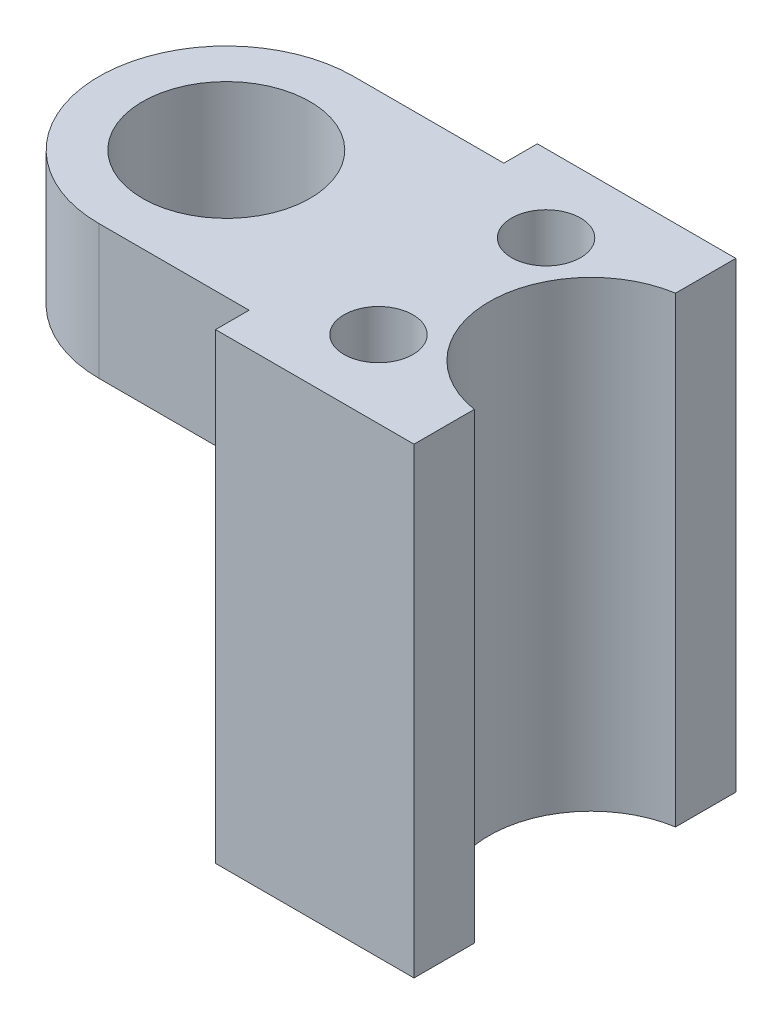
SolidWorks part; units mm, degrees
ref_plane "Front Plane" through (0, 0, 0) normal (0, 0, 1) x (1, 0, 0)
ref_plane "Top Plane" through (0, 0, 0) normal (0, 1, 0) x (1, 0, 0)
ref_plane "Right Plane" through (0, 0, 0) normal (1, 0, 0) x (0, 0, -1)
sketch "Sketch1" plane through (0, 0, 0) normal (0, 1, 0) x (1, 0, 0)
  line L1 (-8.255, 7.62) -> (8.255, 7.62)
  line L2 (-8.255, 7.62) -> (-8.255, -7.62)
  line L3 (-8.255, -7.62) -> (8.255, -7.62)
  line L4 (8.255, 7.62) -> (8.255, -7.62)
  line L5 (-8.255, 7.62) -> (8.255, -7.62) construction
  line L6 (-8.255, -7.62) -> (8.255, 7.62) construction
  arc A0 (-8.255, 7.62) -> (-8.255, -7.62) centre (-8.255, 0) ccw
  point P0 (0, 0)
  dimension "D1" = 16.51
  dimension "D2" = 15.24
extrude "Boss-Extrude1" add sketch "Sketch1" along normal blind 21.8948 contours L2 A0 | L4 L1 L2 L3
sketch "Sketch2" plane through (0, 0, 0) normal (0, -1, 0) x (1, 0, 0)
  line L0 (-1.143, -7.62) -> (-1.143, 7.62)
  line L1 (-8.255, -7.62) -> (8.255, -7.62) construction
  line L2 (-8.255, 7.62) -> (8.255, 7.62) construction
  line L3 (-1.143, 7.62) -> (-8.255, 7.62)
  line L4 (-1.143, -7.62) -> (-8.255, -7.62)
  arc A0 (-8.255, -7.62) -> (-8.255, 7.62) centre (-8.255, 0) cw
  dimension "D1" = 7.112
extrude "Cut-Extrude1" cut sketch "Sketch2" against normal blind 15.5448
sketch "Sketch3" plane through (0, 21.8948, 0) normal (0, 1, 0) x (1, 0, 0)
  line L0 (-15.875, 0) -> (8.255, 0) construction
  line L1 (8.255, 7.62) -> (8.255, -7.62) construction
  arc A0 (-8.255, 7.62) -> (-8.255, -7.62) centre (-8.255, 0) ccw construction
  point P7 (17.907, 0)
  point P8 (5.207, 0)
  dimension "D1" = 6.35
  dimension "D2" = 12.7
sketch "Sketch5" plane through (0, 21.8948, 0) normal (0, 1, 0) x (1, 0, 0)
  circle A0 centre (-8.255, 0) radius 3.9688
  dimension "D1" = 7.9375
extrude "Cut-Extrude2" cut sketch "Sketch5" against normal through all
sketch "Sketch6" plane through (0, 21.8948, 0) normal (0, -1, 0) x (1, 0, 0)
  line L0 (8.255, 0) -> (-1.143, 0) construction
  line L1 (8.255, -7.62) -> (8.255, 7.62) construction
  line L2 (-1.143, -7.62) -> (-1.143, 7.62) construction
  line L3 (2.921, -7.62) -> (2.921, 7.62) construction
  line L4 (-1.143, -7.62) -> (8.255, -7.62) construction
  line L5 (-1.143, 7.62) -> (8.255, 7.62) construction
  point P12 (2.921, -3.9688)
  point P13 (2.921, 3.9687)
  dimension "D1" = 4.064
  dimension "D2" = 3.9688
hole_wizard "#4 Clearance Hole1" positions "3DSketch1" profile "Sketch7" hole size "#4" standard "ANSI Inch"
sketch3d "3DSketch1"
  point P0 (2.921, 21.8948, -3.9688)
  point P3 (2.921, 21.8948, 3.9687)
sketch "Sketch7" plane through (2.921, 21.8948, -3.9688) normal (1, 0, 0) x (0, 0, 1)
  line L0 (0, 0) -> (0, 21.8948)
  line L1 (0, 21.8948) -> (1.6319, 21.8948)
  line L2 (1.6319, 21.8948) -> (1.6319, 0)
  line L5 (1.6319, 0) -> (0, 0)
  line L11 (0, -6.35) -> (0, 107.95) construction
  dimension "Thru Hole Dia." = 3.2639
  dimension "Thru Hole Depth" = 21.8948
sketch "Sketch8" plane through (0, 21.8948, 0) normal (0, 1, 0) x (1, 0, 0)
  line L0 (-15.875, 0) -> (8.255, 0) construction
  circle A0 centre (9.017, 0) radius 4.826
  dimension "D1" = 9.652
  dimension "D2" = 10.16
extrude "Cut-Extrude3" cut sketch "Sketch8" against normal through all
sketch "Sketch9" plane through (0, 15.5448, 0) normal (0, -1, 0) x (1, 0, 0)
  line L0 (-15.875, 0) -> (-1.143, 0) construction
  line L1 (-1.143, -7.62) -> (-1.143, 7.62) construction
  line L2 (-1.143, -6.0325) -> (-8.255, -6.0325)
  line L3 (-1.143, 6.0325) -> (-8.255, 6.0325)
  line L4 (-8.255, -7.62) -> (-1.143, -7.62) construction
  line L5 (-1.143, -6.0325) -> (-1.143, -7.62)
  line L6 (-1.143, -7.62) -> (-8.255, -7.62)
  line L7 (-1.143, 6.0325) -> (-1.143, 7.62)
  line L8 (-1.143, 7.62) -> (-8.255, 7.62)
  arc A0 (-8.255, 7.62) -> (-8.255, -7.62) centre (-8.255, 0) ccw construction
  arc A1 (-8.255, -6.0325) -> (-8.255, 6.0325) centre (-8.255, 0) cw
  arc A2 (-8.255, 7.62) -> (-8.255, -7.62) centre (-8.255, 0) ccw
  dimension "D1" = 1.5875
extrude "Cut-Extrude4" cut sketch "Sketch9" against normal through all
equation "\"D1@Cut-Extrude1\"=0.862in-0.25"
